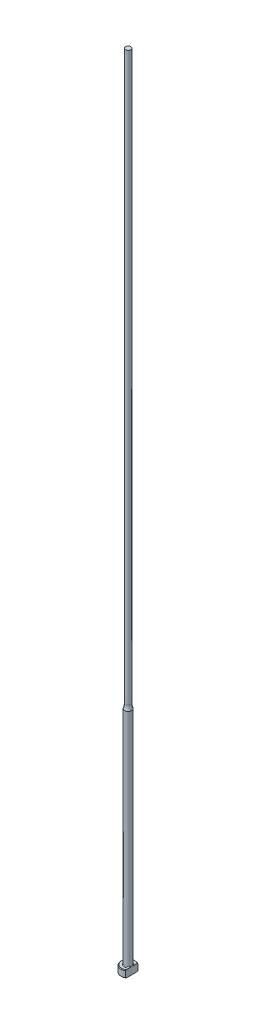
SolidWorks part; units mm, degrees
ref_plane "Front Plane" through (0, 0, 0) normal (0, 0, 1) x (1, 0, 0)
ref_plane "Top Plane" through (0, 0, 0) normal (0, 1, 0) x (1, 0, 0)
ref_plane "Right Plane" through (0, 0, 0) normal (1, 0, 0) x (0, 0, -1)
sketch "Sketch1" plane through (0, 0, 0) normal (0, 0, 1) x (1, 0, 0)
  line L0 (0, 259.9588) -> (0, -15.1925) construction
  line L1 (0, 0) -> (-3.175, 0)
  line L2 (-3.175, 0) -> (-3.175, 3.175)
  line L3 (-3.175, 3.175) -> (-1.5875, 3.175)
  line L4 (-1.19, 103.8114) -> (-1.19, 355.6)
  line L5 (-1.19, 355.6) -> (0, 355.6)
  line L6 (0, 355.6) -> (0, 0)
  line L7 (-1.5875, 3.175) -> (-1.5875, 101.6)
  arc A0 (-1.5875, 101.6) -> (-1.19, 103.8114) centre (-7.54, 103.8114) ccw
  point P13 (-1.5875, 0)
  dimension "D1" = 6.35
  dimension "L" = 355.6
  dimension "D2" = 3.175
  dimension "H" = 6.35
  dimension "T" = 3.175
  dimension "D" = 2.38
  dimension "S" = 101.6
revolve "Revolve1" add sketch "Sketch1" angle 360 about L0
chamfer "Chamfer1" distance 0.254 angle 45 2 edges at (0, 3.175, 3.175) (0, 0, 3.175)
fillet "Fillet1" radius 0.254 1 edges at (0, 3.175, 1.5875)
sketch "Sketch2" plane through (0, 0, 0) normal (0, 1, 0) x (1, 0, 0)
  line L0 (1.5875, -2.7496) -> (1.5875, 2.7496)
  circle A0 centre (0, 0) radius 3.175 construction
  arc A2 (1.5875, -2.7496) -> (1.5875, 2.7496) centre (0, 0) ccw
  circle A3 centre (0, 0) radius 3.175 construction
  circle A4 centre (0, 0) radius 1.5875 construction
extrude "Key Head" cut sketch "Sketch2" along normal up to next
